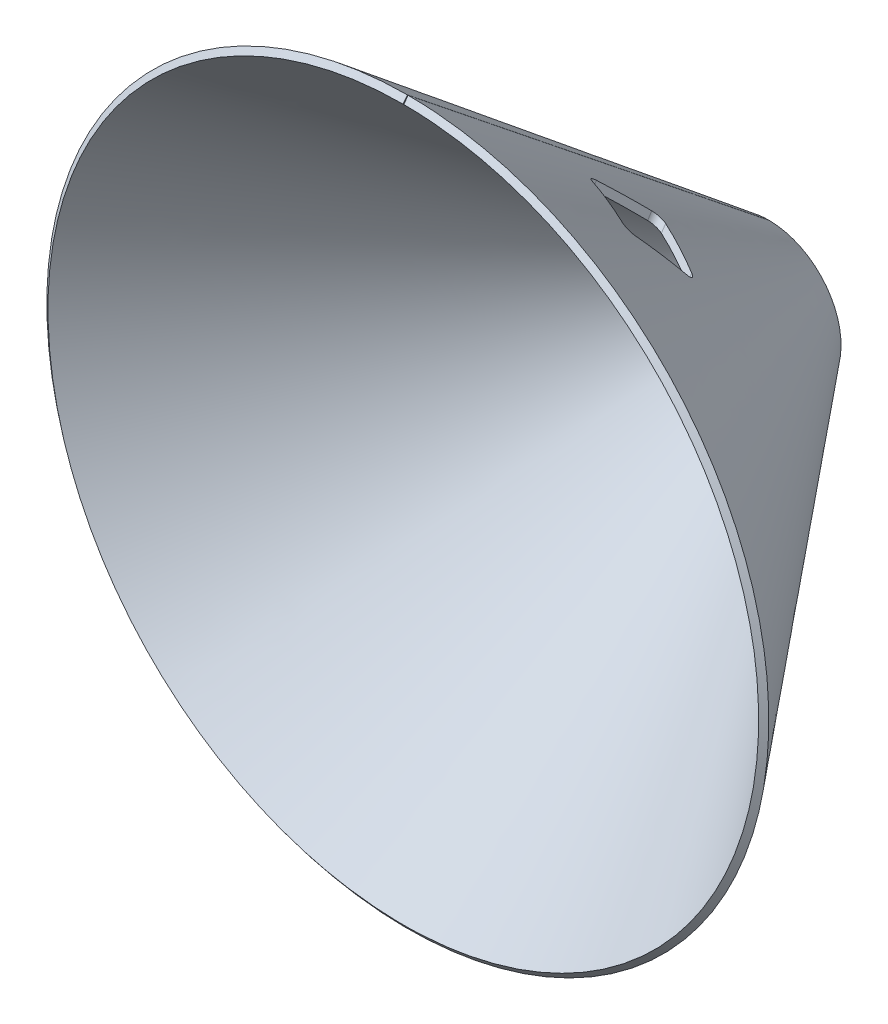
SolidWorks part; units mm, degrees
ref_plane "Ebene vorne" through (0, 0, 0) normal (0, 0, 1) x (1, 0, 0)
ref_plane "Ebene oben" through (0, 0, 0) normal (0, 1, 0) x (1, 0, 0)
ref_plane "Ebene rechts" through (0, 0, 0) normal (1, 0, 0) x (0, 0, -1)
sketch "Skizze1" plane through (0, 0, 0) normal (0, 0, 1) x (1, 0, 0)
  line L0 (0, 0) -> (0, 34.0202) construction
  arc A0 (-0.1, 19.9997) -> (0.1, 19.9997) centre (0, 0) ccw
  dimension "D1" = 0.2
  dimension "D2" = 20
ref_plane "Ebene1" through (0, 0, 100) normal (0, 0, 1) x (1, 0, 0)
sketch "Skizze2" plane through (0, 0, 100) normal (0, 0, 1) x (1, 0, 0)
  line L0 (0, 0) -> (0, 138.3151) construction
  arc A0 (-0.1, 100) -> (0.1, 100) centre (0, 0) ccw
  dimension "D1" = 0.2
  dimension "D2" = 100
sheet metal parameters "Blech1" thickness 2 parameters "D1"=1, "Dicke"=2
lofted bend "Ausgeformte Biegungen1" parameters "D1"=0, "D12"=2
other "Freiform-Biegung1" parameters "D1"=1000, "D4"=57.296, "D5"=1
other "Formnest2"
other "ROHR<2>@Baugruppe22"
flat pattern "Abwicklung1"
sketch "Biegung-Linien1" plane through (0.0287, 17.2413, -6.8965) normal (0.0015, 0.9285, -0.3714) x (-1, 0.0014, -0.0006)
other "Abwickeln-<Freiform-Biegung1>1"
equation "\"Radius\"=0"
equation "\"Stückzahl\"= 1"
